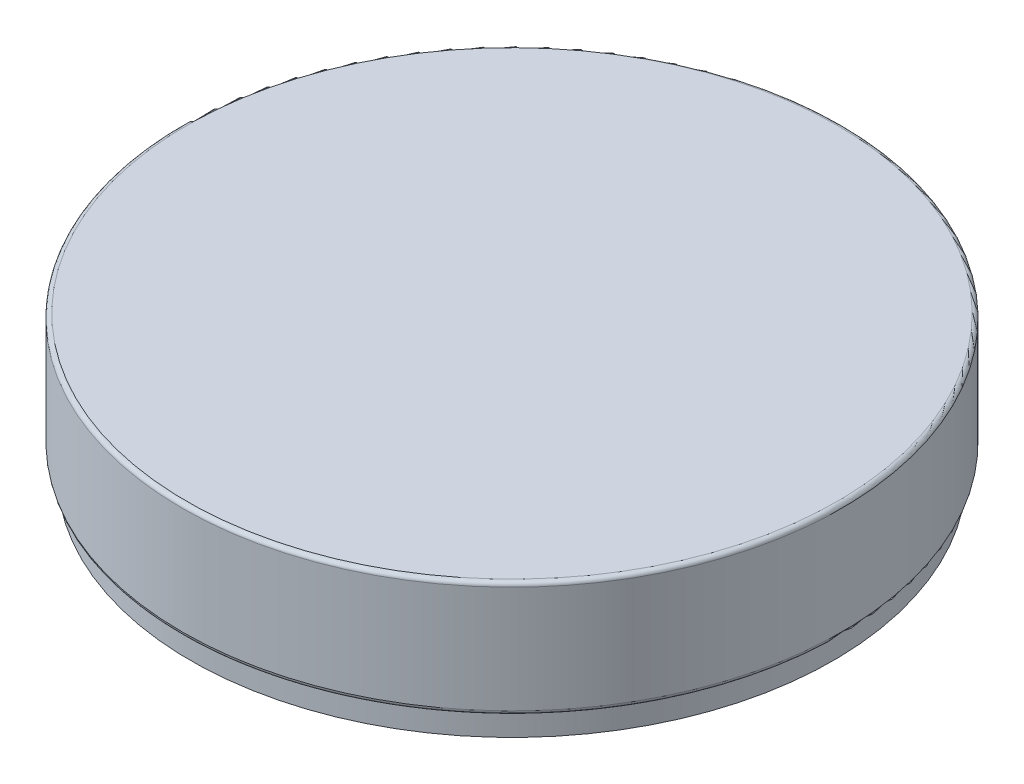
SolidWorks part; units mm, degrees
ref_plane "Alzado" through (0, 0, 0) normal (0, 0, 1) x (1, 0, 0)
ref_plane "Planta" through (0, 0, 0) normal (0, 1, 0) x (1, 0, 0)
ref_plane "Vista lateral" through (0, 0, 0) normal (1, 0, 0) x (0, 0, -1)
sketch "Croquis1" plane through (0, 0, 0) normal (0, 0, 1) x (1, 0, 0)
  line L0 (0, 0) -> (0, 85)
  line L1 (0, 85) -> (197.5, 85)
  line L2 (200, 82.5) -> (200, 17.5)
  line L3 (197.5, 15) -> (0, 15)
  line L4 (0, 0) -> (195, 0)
  line L5 (195, 0) -> (195, 15)
  line L6 (0, -14.3065) -> (0, 102.908) construction
  arc A0 (197.5, 85) -> (200, 82.5) centre (197.5, 82.5) cw
  arc A1 (200, 17.5) -> (197.5, 15) centre (197.5, 17.5) cw
  point P10 (200, 85)
  point P13 (200, 15)
  dimension "D5" = 2.5
  dimension "D6" = 2.5
  dimension "D1" = 200
  dimension "D2" = 195
  dimension "D3" = 70
  dimension "D4" = 85
revolve "Revolución1" add sketch "Croquis1" angle 360 about L6
sketch "Croquis2" plane through (0, 0, 0) normal (0, -1, 0) x (1, 0, 0)
  circle A0 centre (0, 0) radius 190
extrude "Cortar-Extruir1" cut sketch "Croquis2" against normal blind 10
